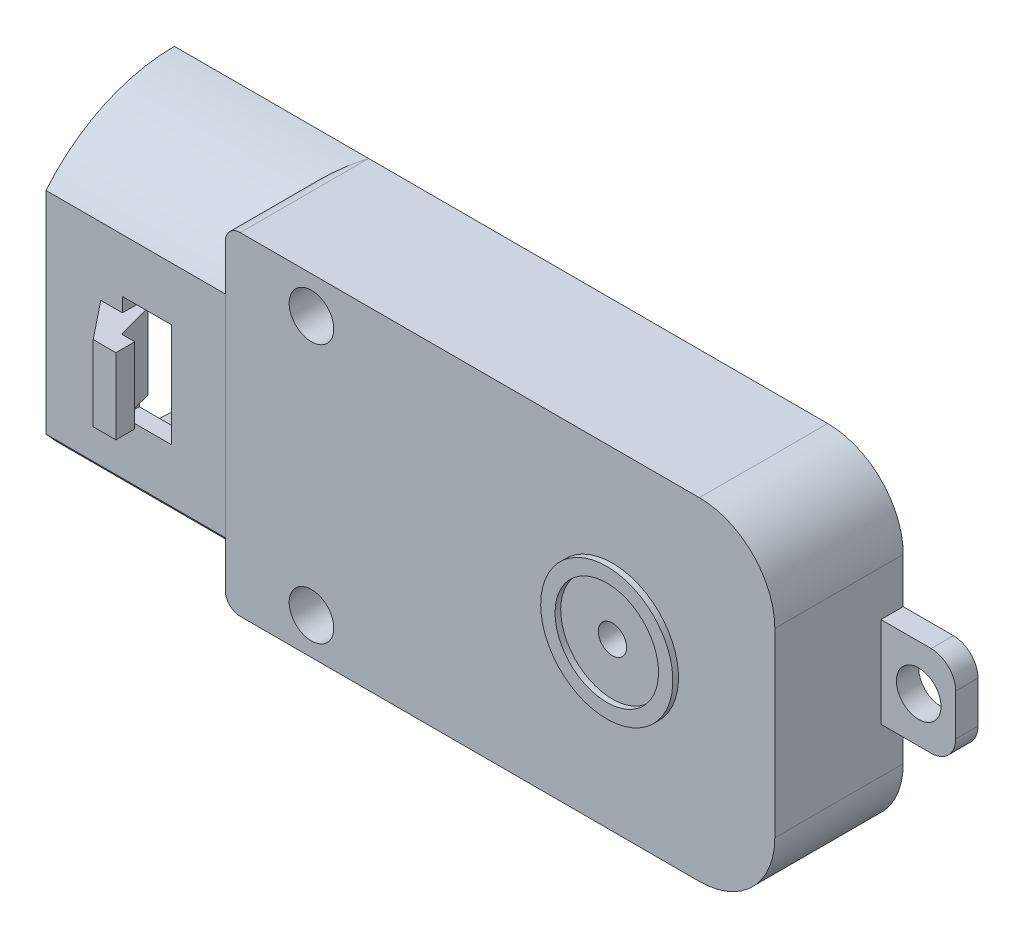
SolidWorks part; units mm, degrees
ref_plane "Front" through (0, 0, 0) normal (0, 0, 1) x (1, 0, 0)
ref_plane "Top" through (0, 0, 0) normal (0, 1, 0) x (1, 0, 0)
ref_plane "Right" through (0, 0, 0) normal (1, 0, 0) x (0, 0, -1)
sketch "Sketch1" plane through (0, 0, 0) normal (0, 0, 1) x (1, 0, 0)
  line L0 (10.922, 0) -> (-49.9329, 0) construction
  line L1 (10.922, 11.176) -> (-38.1, 11.176)
  line L2 (10.922, 11.176) -> (10.922, -11.176)
  line L3 (10.922, -11.176) -> (-38.1, -11.176)
  line L4 (-38.1, 11.176) -> (-38.1, -11.176)
  dimension "D1" = 49.022
  dimension "D2" = 22.352
  dimension "D3" = 10.922
extrude "Extrude1" add sketch "Sketch1" along normal blind 8.636
sketch "Sketch2" plane through (0, 0, 8.636) normal (0, 0, 1) x (1, 0, 0)
  line L0 (10.922, -11.176) -> (10.922, 11.176) construction
  line L1 (10.922, 11.176) -> (-38.1, 11.176) construction
  circle A0 centre (0, 0) radius 0.9525
  circle A3 centre (-20.2438, 8.7122) radius 1.5
  dimension "D1" = 1.905
  dimension "D2" = 2.4638
  dimension "D6" = 3
  dimension "D7" = 31.1658
extrude "Cut-Extrude1" cut sketch "Sketch2" against normal through all
ref_plane "Plane1" through (0, 0, 0) normal (0, 1, 0) x (-1, 0, 0)
mirror "Mirror1" about plane through (0, 0, 0) normal (0, 1, 0) of "Cut-Extrude1"
fillet "Fillet1" radius 5.08 2 edges at (10.922, -11.176, 4.318) (10.922, 11.176, 4.318)
sketch "Sketch3" plane through (0, 0, 8.636) normal (0, 0, 1) x (1, 0, 0)
  circle A0 centre (0, 0) radius 4.445
  circle A1 centre (0, 0) radius 3.4798
  dimension "D1" = 0.9652
  dimension "D2" = 8.89
extrude "Extrude2" add sketch "Sketch3" along normal blind 0.381
sketch "Sketch4" plane through (-38.1, 0, 0) normal (-1, 0, 0) x (0, 0, 1)
  line L0 (8.636, 11.176) -> (0, 11.176) construction
  line L3 (8.636, 11.176) -> (8.636, -11.176) construction
  line L5 (8.6335, 7.0969) -> (8.6335, 0)
  arc A0 (8.6335, 7.0969) -> (0, 11.176) centre (0, 0) ccw
  dimension "D1" = 0.0025
extrude "Cut-Extrude-Thin1" cut sketch "Sketch4" against normal blind 12.065 thin
mirror "Mirror5" about plane through (0, 0, 0) normal (0, 1, 0) of "Cut-Extrude-Thin1"
fillet "Fillet2" radius 1 2 edges at (-26.035, 11.176, 4.318) (-26.035, -11.176, 4.318)
sketch "Sketch8" plane through (0, 0, 8.6335) normal (0, 0, 1) x (1, 0, 0)
  line L0 (-38.1, -7.0969) -> (-38.1, 7.0969) construction
  line L1 (-29.6545, 3.4925) -> (-32.9565, 3.4925)
  line L2 (-29.6545, 3.4925) -> (-29.6545, -3.4925)
  line L3 (-29.6545, -3.4925) -> (-32.9565, -3.4925)
  line L4 (-32.9565, 3.4925) -> (-32.9565, -3.4925)
  line L5 (-38.1, -11.176) -> (-25.035, -11.176) construction
  dimension "D1" = 6.985
  dimension "D2" = 3.302
  dimension "D3" = 5.1435
  dimension "D4" = 7.6835
extrude "Cut-Extrude8" cut sketch "Sketch8" against normal blind 10
sketch "Sketch7" plane through (-38.1, 0, 0) normal (-1, 0, 0) x (0, 0, 1)
  line L0 (8.6335, -7.0969) -> (8.6335, 7.0969) construction
  line L1 (0, 11.176) -> (0, -11.176) construction
  line L2 (8.6335, -7.0969) -> (8.6335, 7.0969) construction
  line L3 (0, 11.176) -> (0, -11.176) construction
  line L4 (7.5035, -6.6798) -> (7.5035, 6.6798)
  line L5 (0, 10.046) -> (0, -10.046)
  arc A0 (0, -11.176) -> (8.6335, -7.0969) centre (0, 0) ccw construction
  arc A1 (8.6335, 7.0969) -> (0, 11.176) centre (0, 0) ccw construction
  arc A2 (0, -11.176) -> (8.6335, -7.0969) centre (0, 0) ccw construction
  arc A3 (8.6335, 7.0969) -> (0, 11.176) centre (0, 0) ccw construction
  arc A4 (7.5035, 6.6798) -> (0, 10.046) centre (0, 0) ccw
  arc A5 (0, -10.046) -> (7.5035, -6.6798) centre (0, 0) ccw
  dimension "D1" = 1.13
extrude "Cut-Extrude7" cut sketch "Sketch7" against normal blind 12
ref_plane "Plane2" through (0, 2.54, 0) normal (0, -1, 0) x (1, 0, 0)
sketch "Sketch9" plane through (0, 2.54, 0) normal (0, -1, 0) x (1, 0, 0)
  line L0 (-34.417, 8.6335) -> (-32.385, 11.1735)
  line L1 (-32.385, 11.1735) -> (-30.861, 11.1735)
  line L2 (-30.861, 11.1735) -> (-30.861, 9.9035)
  line L3 (-30.861, 9.9035) -> (-31.75, 9.9035)
  line L4 (-31.75, 9.9035) -> (-32.385, 7.5035)
  line L5 (-32.385, 7.5035) -> (-32.9565, 7.5035)
  line L6 (-26.035, 8.6335) -> (-38.1, 8.6335) construction
  line L8 (-32.9565, 7.5035) -> (-32.9565, 8.6335)
  line L9 (-32.9565, 8.6335) -> (-34.417, 8.6335)
  line L10 (-38.1, 8.6335) -> (-38.1, 0) construction
  dimension "D1" = 2.54
  dimension "D2" = 3.683
  dimension "D3" = 5.715
  dimension "D4" = 1.27
  dimension "D5" = 7.239
  dimension "D6" = 0.889
  dimension "D7" = 5.715
extrude "Extrude3" add sketch "Sketch9" along normal blind 5.08
sketch "Sketch10" plane through (0, 0, 0) normal (0, 0, -1) x (-1, 0, 0)
  line L0 (5.2027, 0) -> (-5.2027, 0) construction
  line L1 (0, 0) -> (-14.537, 0) construction
  line L3 (-10.922, -6.096) -> (-10.922, 6.096) construction
  line L5 (-10.922, 3.048) -> (-14.3002, 3.048)
  line L6 (-10.922, 3.048) -> (-10.922, -3.048)
  line L7 (-10.922, -3.048) -> (-14.3002, -3.048)
  line L8 (-15.9512, 1.397) -> (-15.9512, -1.397)
  circle A0 centre (-13.462, 0) radius 1.5
  arc A1 (-14.3002, -3.048) -> (-15.9512, -1.397) centre (-14.3002, -1.397) cw
  arc A2 (-14.3002, 3.048) -> (-15.9512, 1.397) centre (-14.3002, 1.397) ccw
  dimension "D1" = 3
  dimension "D2" = 2.54
  dimension "D3" = 5.0292
  dimension "D5" = 6.096
  dimension "D6" = 1.651
  dimension "D4" = 3.048
extrude "Extrude4" add sketch "Sketch10" against normal blind 1.5
sketch "Skica1" plane through (0, 0, 8.636) normal (0, 0, 1) x (1, 0, 0)
  point P0 (-20.2438, 8.7122)
  point P1 (-20.2438, -8.7122)
  point P3 (13.462, 0)
  dimension "D1" = 17.4244
  dimension "D2" = 33.7058
